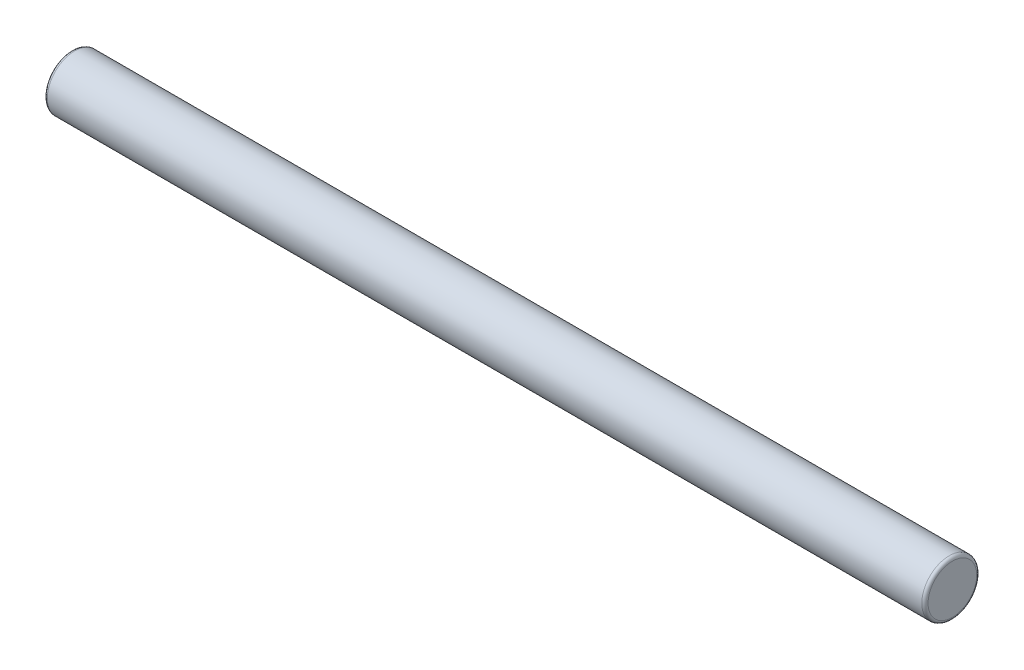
SolidWorks part; units mm, degrees
ref_plane "Front" through (0, 0, 0) normal (0, 0, 1) x (1, 0, 0)
ref_plane "Top" through (0, 0, 0) normal (0, 1, 0) x (1, 0, 0)
ref_plane "Right" through (0, 0, 0) normal (1, 0, 0) x (0, 0, -1)
sketch "Schizzo1" plane through (0, 0, 0) normal (0, 0, 1) x (1, 0, 0)
  line L0 (-280.5, 0) -> (280.5, 0) construction
  line L1 (-280.5, 0) -> (-280.5, 17.5)
  line L2 (-280.5, 17.5) -> (280.5, 17.5)
  line L3 (280.5, 17.5) -> (280.5, 0)
  line L4 (-280.5, 0) -> (280.5, 0)
  point P3 (0, 0)
  dimension "D1" = 35
  dimension "D2" = 561
revolve "Rivoluzione1" add sketch "Schizzo1" angle 360 about L0
fillet "Raccordo1" radius 2 2 edges at (-280.5, -17.5, 0) (280.5, -17.5, 0)
